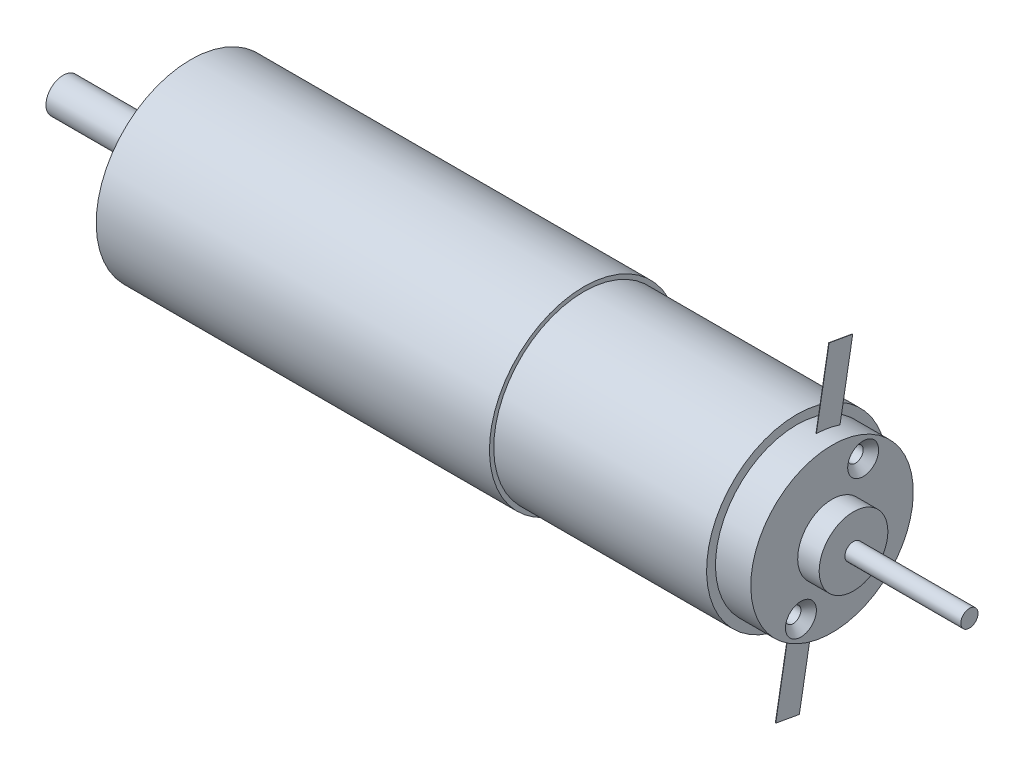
SolidWorks part; units mm, degrees
ref_plane "Front Plane" through (0, 0, 0) normal (0, 0, 1) x (1, 0, 0)
ref_plane "Top Plane" through (0, 0, 0) normal (0, 1, 0) x (1, 0, 0)
ref_plane "Right Plane" through (0, 0, 0) normal (1, 0, 0) x (0, 0, -1)
sketch "Sketch1" plane through (0, 0, 0) normal (0, 0, 1) x (1, 0, 0)
  line L0 (44.9, 0) -> (-60.65, 0) construction
  line L1 (0, -10.5) -> (24.7852, -10.5)
  line L2 (0, -10.5) -> (0, -11)
  line L3 (0, -11) -> (-45.8, -11)
  line L4 (24.7852, -10.5) -> (24.7852, -9.4615)
  line L5 (-45.8, -11) -> (-45.8, -5)
  line L6 (-45.8, -5) -> (-47.15, -5)
  line L7 (-47.15, -5) -> (-47.15, -3.4925)
  line L8 (-47.15, -3.4925) -> (-48.95, -3.4925)
  line L9 (-48.95, -3.4925) -> (-48.95, -2)
  line L10 (-48.95, -2) -> (-60.65, -2)
  line L11 (-60.65, -2) -> (-60.65, 0)
  line L12 (28.9, -4) -> (31.4, -4)
  line L13 (24.7852, -9.4615) -> (28.9, -9.4615)
  line L14 (28.9, -9.4615) -> (28.9, -4)
  line L15 (31.4, -4) -> (31.4, -1)
  line L16 (31.4, -1) -> (44.9, -1)
  line L17 (44.9, -1) -> (44.9, 0)
  line L18 (-60.65, 0) -> (44.9, 0)
  dimension "D1" = 22
  dimension "D2" = 28.9
  dimension "D3" = 21
  dimension "D4" = 45.8
  dimension "D5" = 10
  dimension "D6" = 1.35
  dimension "D7" = 6.985
  dimension "D8" = 3.15
  dimension "D9" = 4
  dimension "D10" = 14.85
  dimension "D11" = 18.923
  dimension "D12" = 4.1148
  dimension "D13" = 8
  dimension "D14" = 2.5
  dimension "D15" = 2
  dimension "D16" = 16
revolve "Revolve1" add sketch "Sketch1" angle 360 about L0
sketch "Sketch6" plane through (0, 0, 0) normal (0, 1, 0) x (1, 0, 0)
  line L0 (-60.65, 2) -> (-60.65, -2) construction
  line L1 (-63.9871, 5.1812) -> (-51.35, 5.1812)
  line L2 (-63.9871, 5.1812) -> (-63.9871, 1.5)
  line L3 (-63.9871, 1.5) -> (-51.35, 1.5)
  line L4 (-51.35, 5.1812) -> (-51.35, 1.5)
  line L5 (-60.65, -2) -> (-48.95, -2) construction
  dimension "D1" = 9.3
  dimension "D2" = 3.5
extrude "Cut-Extrude2" cut sketch "Sketch6" against normal through all and the other way through all
sketch "Sketch2" plane through (24.7852, 0, 0) normal (1, 0, 0) x (0, 0, -1)
  line L0 (0.9263, 5.2534) -> (0, 0) construction
  line L1 (1.7296, 17.8712) -> (-0.4524, 5.4965)
  line L2 (1.7296, 17.8712) -> (4.487, 17.385)
  line L3 (4.487, 17.385) -> (2.305, 5.0103)
  line L4 (-0.4524, 5.4965) -> (2.305, 5.0103)
  line L5 (0.9263, 5.2534) -> (3.1083, 17.6281) construction
  line L6 (0, 0) -> (0, 15.5687) construction
  line L7 (0, 0) -> (-7.582, 1.3369) construction
  line L8 (-4.487, -17.385) -> (-1.7296, -17.8712)
  line L9 (-4.487, -17.385) -> (-2.305, -5.0103)
  line L10 (-1.7296, -17.8712) -> (0.4524, -5.4965)
  line L11 (-2.305, -5.0103) -> (0.4524, -5.4965)
  dimension "D1" = 2.8
  dimension "D2" = 17.9
  dimension "D3" = 10
extrude "Extrude1" add sketch "Sketch2" along normal blind 0.04 from offset 2
hole_wizard "M2.5x0.45 Tapped Hole1" positions "Sketch5" profile "Sketch4" tap size "M2.5x0.45" standard "Ansi Metric"
sketch "Sketch5" plane through (-45.8, 0, 0) normal (-1, 0, 0) x (0, 0, 1)
  line L0 (0, 0) -> (0, 7) construction
  line L1 (0, 0) -> (6.0622, -3.5) construction
  line L2 (0, 0) -> (-6.0622, -3.5) construction
  circle A0 centre (0, 0) radius 7 construction
  point P0 (0, 7)
  point P1 (6.0622, -3.5)
  point P3 (-6.0622, -3.5)
  dimension "D3" = 14
  dimension "D1" = 120
  dimension "D2" = 120
sketch "Sketch4" plane through (-45.8, 7, 0) normal (0, 1, 0) x (0, 0, 1)
  line L0 (0, 0) -> (0, 5.9659)
  line L1 (0, 5.9659) -> (1.025, 5.35)
  line L2 (1.025, 5.35) -> (1.025, 0)
  line L5 (1.025, 0) -> (0, 0)
  line L10 (0, 5.9659) -> (-1.025, 5.35) construction
  line L11 (0, -6.35) -> (0, 107.95) construction
  dimension "Tap Drill Dia." = 2.05
  dimension "Tap Drill Depth" = 5.35
  dimension "Drill Angle" = 118
hole_wizard "CSK for M1.6 Countersunk Flat Head1" positions "Sketch8" profile "Sketch7" countersink size "M1.6" standard "BSI"
sketch "Sketch8" plane through (28.9, 0, 0) normal (1, 0, 0) x (0, 0, -1)
  line L0 (0, 0) -> (0, 12.9146) construction
  line L1 (0, 0) -> (3.625, 6.2787) construction
  line L2 (0, 0) -> (-3.625, -6.2787) construction
  circle A0 centre (0, 0) radius 7.25 construction
  point P0 (3.625, 6.2787)
  point P11 (-3.625, -6.2787)
  dimension "D1" = 30
  dimension "D2" = 14.5
sketch "Sketch7" plane through (28.9, 6.2787, -3.625) normal (0, 1, 0) x (0, 0, -1)
  line L0 (0, 0) -> (0, 4.8908)
  line L1 (0, 4.8908) -> (0.9, 4.35)
  line L2 (0.9, 4.35) -> (0.9, 0.9)
  line L3 (0.9, 0.9) -> (1.8, 0)
  line L5 (1.8, 0) -> (0, 0)
  line L6 (-0.9, 0.9) -> (-1.8, 0) construction
  line L10 (0, 4.8908) -> (-0.9, 4.35) construction
  line L11 (0, -6.35) -> (0, 107.95) construction
  dimension "Hole Dia." = 1.8
  dimension "Hole Depth" = 4.35
  dimension "Near C'Sink Dia." = 3.6
  dimension "Near C'Sink Angle" = 90
  dimension "Drill Angle" = 118
